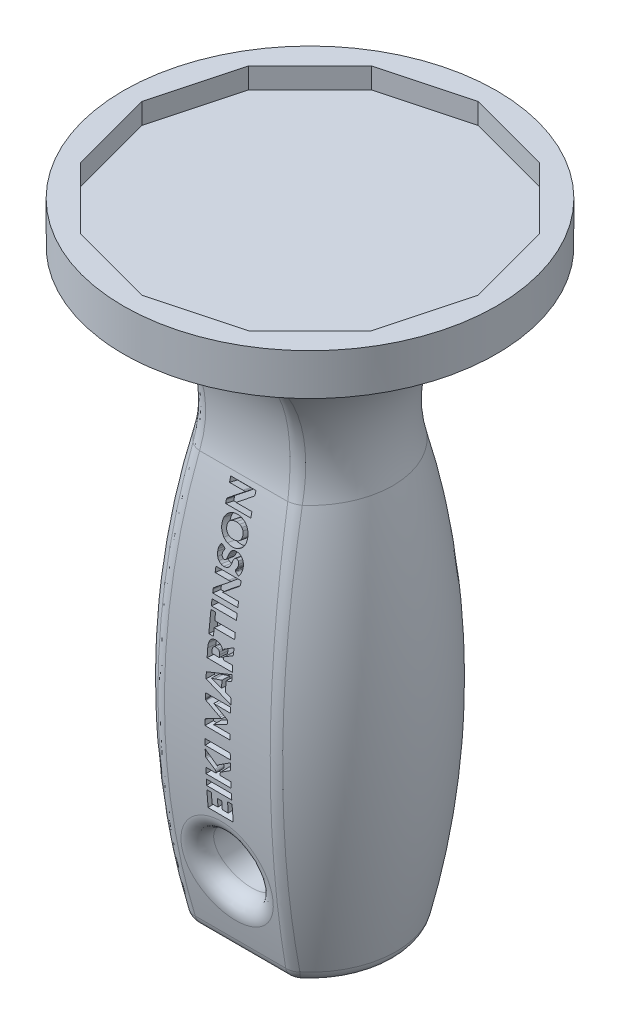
SolidWorks part; units mm, degrees
ref_plane "Front Plane" through (0, 0, 0) normal (0, 0, 1) x (1, 0, 0)
ref_plane "Top Plane" through (0, 0, 0) normal (0, 1, 0) x (1, 0, 0)
ref_plane "Right Plane" through (0, 0, 0) normal (1, 0, 0) x (0, 0, -1)
sketch "Sketch1" plane through (0, 0, 0) normal (0, 1, 0) x (1, 0, 0)
  line L1 (0, 25.7175) -> (-12.8587, 22.272)
  line L2 (-12.8587, 22.272) -> (-22.272, 12.8587)
  line L3 (-22.272, 12.8587) -> (-25.7175, 0)
  line L4 (-25.7175, 0) -> (-22.272, -12.8587)
  line L5 (-22.272, -12.8587) -> (-12.8588, -22.272)
  line L6 (-12.8588, -22.272) -> (0, -25.7175)
  line L7 (0, -25.7175) -> (12.8587, -22.272)
  line L8 (12.8587, -22.272) -> (22.272, -12.8588)
  line L9 (22.272, -12.8588) -> (25.7175, 0)
  line L10 (25.7175, 0) -> (22.272, 12.8587)
  line L11 (22.272, 12.8587) -> (12.8588, 22.272)
  line L12 (12.8588, 22.272) -> (0, 25.7175)
  circle A0 centre (0, 0) radius 24.8412 construction
  dimension "D1" = 51.435
sketch "Sketch3" plane through (0, 0, 0) normal (0, 1, 0) x (1, 0, 0)
  circle A0 centre (0, 0) radius 28.575
  dimension "D1" = 57.15
extrude "Boss-Extrude2" add sketch "Sketch3" against normal blind 6.35
extrude "Cut-Extrude1" cut sketch "Sketch1" against normal blind 3.175
sketch "Sketch4" plane through (0, 0, 0) normal (0, 0, 1) x (1, 0, 0)
  line L0 (-12.7, -95.25) -> (0, -95.25)
  line L1 (0, -95.25) -> (0, -6.35)
  line L2 (-28.575, -6.35) -> (28.575, -6.35) construction
  line L3 (0, -6.35) -> (-28.575, -6.35)
  arc A0 (-28.575, -6.35) -> (-12.7, -31.75) centre (-32.6966, -26.5869) cw
  arc A1 (-12.7, -31.75) -> (-12.7, -95.25) centre (110.2672, -63.5) ccw
  dimension "D3" = 127
  dimension "D1" = 88.9
  dimension "D2" = 63.5
  dimension "D4" = 12.7
revolve "Revolve1" add sketch "Sketch4" angle 360 about L1
sketch "Sketch8" plane through (0, 0, 0) normal (1, 0, 0) x (0, 0, -1)
  line L0 (12.7, -31.75) -> (-12.7, -31.75) construction
  line L1 (28.575, -6.35) -> (-28.575, -6.35) construction
  line L2 (-12.7, -95.25) -> (12.7, -95.25) construction
  line L3 (-10.16, -95.25) -> (-12.7, -95.25) construction
  line L4 (-12.7, -31.75) -> (-10.16, -31.75) construction
  line L5 (-10.16, -95.25) -> (-28.575, -95.25)
  line L6 (-28.575, -95.25) -> (-28.575, -6.35)
  arc A0 (-10.16, -95.25) -> (-10.16, -31.75) centre (112.8072, -63.5) cw
  arc A1 (-10.16, -31.75) -> (-28.575, -6.35) centre (-29.8665, -26.6618) ccw
  arc A2 (-12.7, -31.75) -> (-28.575, -6.35) centre (-32.6966, -26.5869) ccw construction
  arc A3 (-12.7, -31.75) -> (-12.7, -95.25) centre (110.2672, -63.5) ccw construction
  arc A6 (-12.7, -31.75) -> (-12.7, -95.25) centre (110.2672, -63.5) ccw construction
  dimension "D1" = 2.54
extrude "Cut-Extrude4" cut sketch "Sketch8" against normal through all both and the other way through all
sketch "Sketch5" plane through (0, 0, 0) normal (0, 0, 1) x (1, 0, 0)
  line L1 (-7.62, -95.25) -> (7.62, -95.25) construction
  circle A0 centre (0, -82.55) radius 4.445
  dimension "D1" = 8.89
  dimension "D2" = 12.7
extrude "Cut-Extrude2" cut sketch "Sketch5" against normal through all both and the other way through all
mirror "Mirror1" about plane through (0, 0, 0) normal (0, 0, 1) of "Cut-Extrude4"
fillet "Fillet1" radius 2.54 14 edges at (8.7071, -51.8131, -13.6539) (-8.7071, -75.1869, -13.6539) (-8.7071, -75.1869, 13.6539) (8.7071, -51.8131, 13.6539) (-9.3066, -7.5508, -22.8661) (9.4166, -8.037, -21.6596) (9.4166, -8.037, 21.6596) (-9.3066, -7.5508, 22.8661) (-4.3268, -83.5681, -12.5972) (-4.3236, -81.5181, 12.9081) (12.7, -95.25, 0) (-12.7, -95.25, 0) (0, -95.25, -10.16) (0, -95.25, 10.16)
ref_plane "Plane1" through (0, 0, 0) normal (0, 0, -1) x (-1, 0, 0)
sketch "Sketch6" plane through (0, 0, 0) normal (0, 0, 1) x (1, 0, 0)
  line L0 (0, -72.8255) -> (0, 0) construction
  line L2 (28.575, 0) -> (-28.575, 0) construction
  dimension "D1" = 74.93
sketch_block_instance "Block2-2"
sketch_block "Block2"
wrap "Wrap2" sketch "Sketch6" wrap type deboss source sketch "Sketch6" thickness 1.27 parameters "D1"=1.27
sketch "Sketch9" plane through (0, 0, 0) normal (0, 0, -1) x (-1, 0, 0)
  line L0 (0, -53.0068) -> (0, 0) construction
  line L1 (28.575, 0) -> (-28.575, 0) construction
  dimension "D1" = 71.12
sketch_block_instance "Block3-2"
sketch_block "Block3"
wrap "Wrap3" sketch "Sketch9" wrap type deboss source sketch "Sketch9" thickness 1.27 parameters "D1"=1.27
